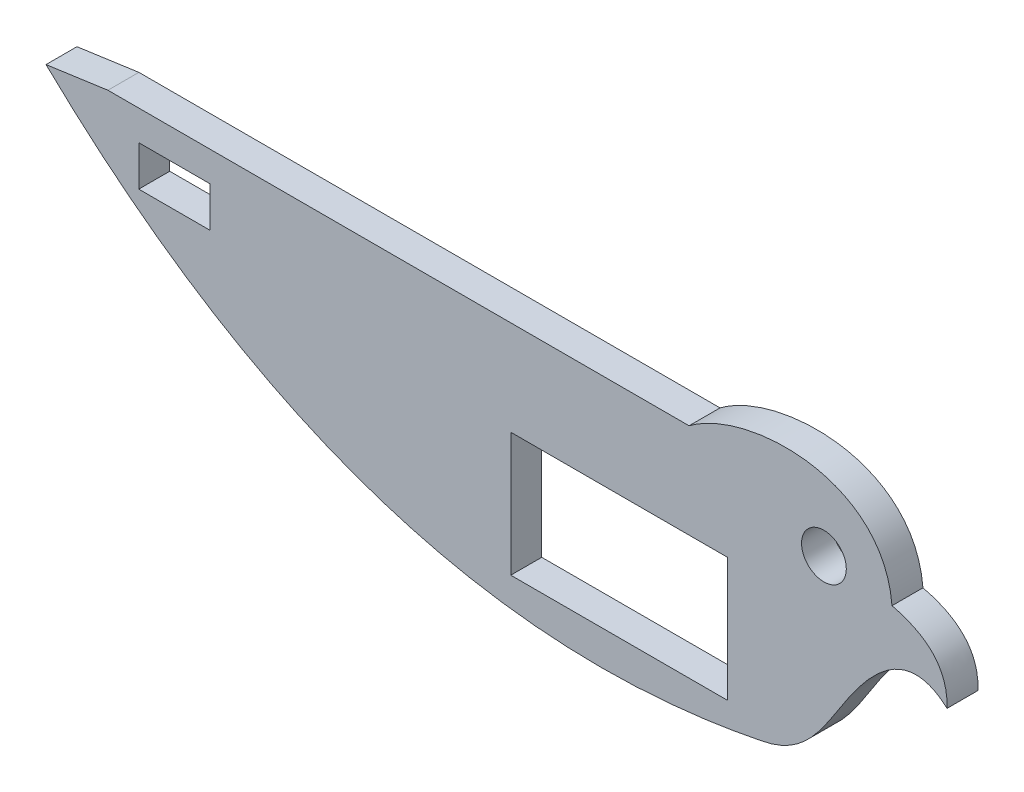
SolidWorks part; units mm, degrees
ref_plane "Front Plane" through (0, 0, 0) normal (0, 0, 1) x (1, 0, 0)
ref_plane "Top Plane" through (0, 0, 0) normal (0, 1, 0) x (1, 0, 0)
ref_plane "Right Plane" through (0, 0, 0) normal (1, 0, 0) x (0, 0, -1)
sketch "Sketch2" plane through (0, 0, 0) normal (0, 0, 1) x (1, 0, 0)
  line L0 (81.8765, 27.2193) -> (-105.831, 27.2193)
  line L1 (-125.831, 24.4008) -> (-105.831, 27.2193)
  line L3 (-95.8708, 17.535) -> (-72.8708, 17.535)
  line L4 (-95.8708, 17.535) -> (-95.8708, 4.535)
  line L5 (-95.8708, 4.535) -> (-72.8708, 4.535)
  line L6 (-72.8708, 17.535) -> (-72.8708, 4.535)
  line L7 (-95.8708, 17.535) -> (-72.8708, 4.535) construction
  line L8 (-95.8708, 4.535) -> (-72.8708, 17.535) construction
  line L9 (94.2821, -43.3748) -> (24.2821, -43.3748)
  line L10 (94.2821, -43.3748) -> (94.2821, -3.3748)
  line L11 (94.2821, -3.3748) -> (24.2821, -3.3748)
  line L12 (24.2821, -43.3748) -> (24.2821, -3.3748)
  line L13 (94.2821, -43.3748) -> (24.2821, -3.3748) construction
  line L14 (94.2821, -3.3748) -> (24.2821, -43.3748) construction
  circle A0 centre (125.4273, 12.5445) radius 7.2273
  spline S0 degree 3 poles (81.8765, 27.2193) (101.5176, 41.9344) (144.5929, 42.2588) (147.4218, 9.6613) knots 0 0 0 0 1 1 1 1
  spline S1 degree 2 poles (147.4218, 9.6613) (165.7054, 5.2189) (165.1911, -10.1776) knots 0 0 0 1 1 1
  spline S2 degree 3 poles (165.1911, -10.1776) (153.8892, 0.0672) (130.1074, -21.4934) (121.6446, -46.2763) (105.072, -49.2513) knots 0 0 0 0 0.442507 1 1 1 1
  spline S3 degree 2 poles (105.072, -49.2513) (-22.4432, -75.1159) (-125.831, 24.4008) knots 0 0 0 1 1 1
  point P1 (-91.9767, 0)
  point P19 (59.2821, -23.3748)
  dimension "D1" = 23
  dimension "D2" = 13
  dimension "D3" = 70
  dimension "D4" = 40
  dimension "D5" = 20
extrude "Boss-Extrude1" add sketch "Sketch2" along normal mid plane 10
